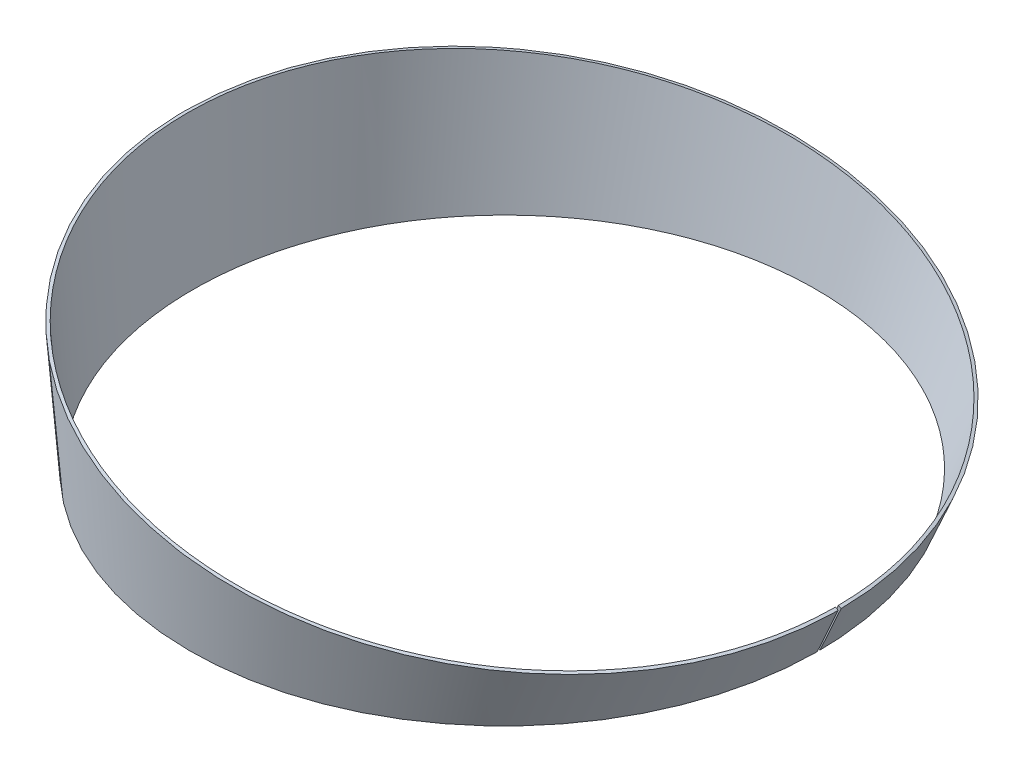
SolidWorks part; units mm, degrees
ref_plane "Ebene vorne" through (0, 0, 0) normal (0, 0, 1) x (1, 0, 0)
ref_plane "Ebene oben" through (0, 0, 0) normal (0, 1, 0) x (1, 0, 0)
ref_plane "Ebene rechts" through (0, 0, 0) normal (1, 0, 0) x (0, 0, -1)
sketch "Skizze1" plane through (0, 0, 0) normal (0, 0, 1) x (1, 0, 0)
  line L0 (0, 0) -> (40, 0) construction
  line L1 (40, 0) -> (0.4925, 6.2574) construction
  arc A0 (0.4925, 6.2574) -> (0, 0) centre (40, 0) ccw
  dimension "D1" = 9
  dimension "D2" = 40
ref_plane "Ebene1" through (0.4925, 6.2574, 0) normal (-0.1564, -0.9877, 0) x (0.9877, -0.1564, 0)
sketch "Skizze2" plane through (0, 0, 0) normal (0, 1, 0) x (1, 0, 0)
  line L0 (19.9998, 0.0873) -> (0, 0) construction
  line L1 (0, 0) -> (19.9998, -0.0873) construction
  line L2 (19.9998, -0.0873) -> (19.9998, 0.0873) construction
  arc A0 (19.9998, 0.0873) -> (19.9998, -0.0873) centre (0, 0) ccw
  dimension "D1" = 40
  dimension "D2" = 0.5
sketch "Skizze3" plane through (0.4925, 6.2574, 0) normal (-0.1564, -0.9877, 0) x (0.9877, -0.1564, 0)
  line L0 (21.1058, -0.0921) -> (0, 0) construction
  line L1 (0, 0) -> (21.1058, 0.0921) construction
  line L2 (21.1058, 0.0921) -> (21.1058, -0.0921) construction
  arc A0 (21.1058, 0.0921) -> (21.1058, -0.0921) centre (0, 0) ccw
  dimension "D1" = 42.212
  dimension "D2" = 0.5
sheet metal parameters "Blech1" thickness 0.2 parameters "D1"=2, "Dicke"=0.2
lofted bend "Ausgeformte Biegungen1" parameters "D1"=0, "D12"=0.2
other "Freiform-Biegung1" parameters "D1"=1000, "D4"=57.296, "D5"=1
flat pattern "Abwicklung1"
sketch "Biegung-Linien1" plane through (0, 0, 0) normal (0, 1, 0) x (-1, 0, 0)
other "Abwickeln-<Freiform-Biegung1>1"
